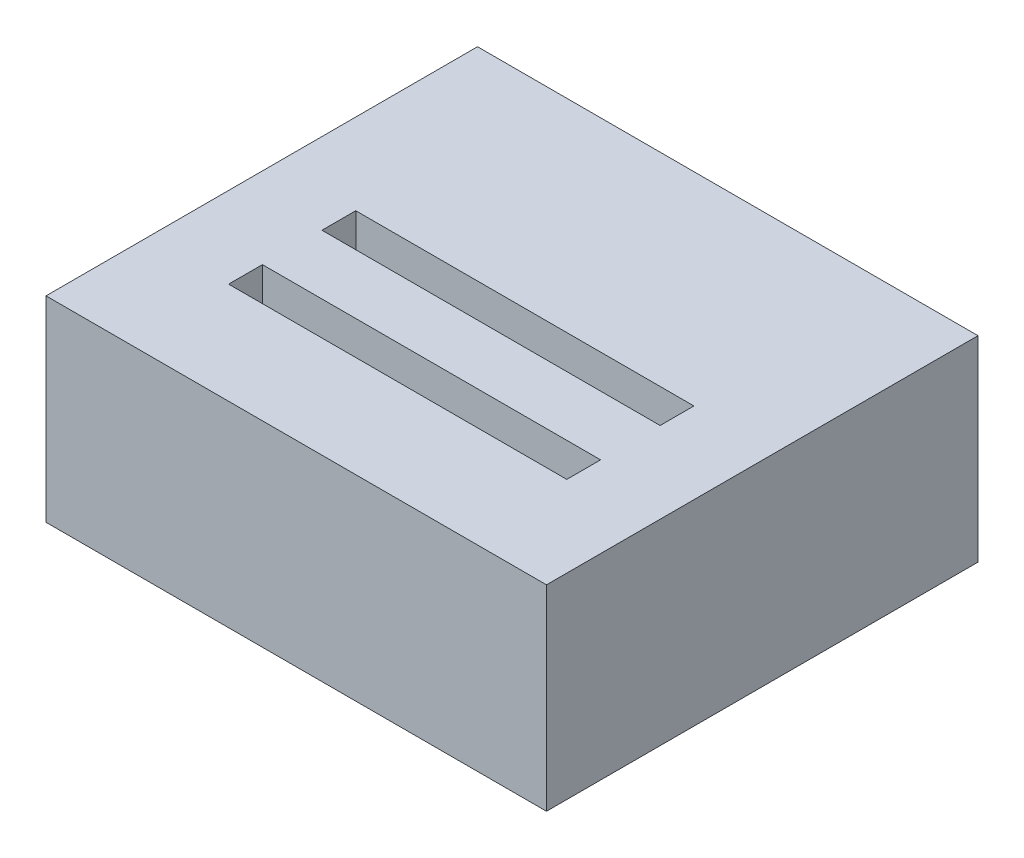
SolidWorks part; units mm, degrees
ref_plane "Front Plane" through (0, 0, 0) normal (0, 0, 1) x (1, 0, 0)
ref_plane "Top Plane" through (0, 0, 0) normal (0, 1, 0) x (1, 0, 0)
ref_plane "Right Plane" through (0, 0, 0) normal (1, 0, 0) x (0, 0, -1)
sketch "Sketch1" plane through (0, 0, 0) normal (0, 0, 1) x (1, 0, 0)
  line L1 (-4.318, 4.953) -> (14.478, 4.953)
  line L2 (-4.318, 4.953) -> (-4.318, -2.413)
  line L3 (-4.318, -2.413) -> (14.478, -2.413)
  line L4 (14.478, 4.953) -> (14.478, -2.413)
extrude "Boss-Extrude1" add sketch "Sketch1" along normal blind 7.62
sketch "Sketch2" plane through (0, 0, 0) normal (0, 0, -1) x (-1, 0, 0)
  circle A0 centre (0, 0) radius 0.508
  circle A1 centre (-2.54, 0) radius 0.508
  circle A2 centre (-5.08, 0) radius 0.508
  circle A3 centre (-7.62, 0) radius 0.508
  circle A4 centre (-10.16, 0) radius 0.508
  circle A12 centre (0, 2.54) radius 0.508
  circle A13 centre (-2.54, 2.54) radius 0.508
  circle A14 centre (-5.08, 2.54) radius 0.508
  circle A15 centre (-7.62, 2.54) radius 0.508
  circle A16 centre (-10.16, 2.54) radius 0.508
extrude "Cut-Extrude1" cut sketch "Sketch2" against normal up to surface (7.62 mm away)
sketch "Sketch3" plane through (0, 0, 7.62) normal (0, 0, 1) x (1, 0, 0)
  line L0 (-4.318, -2.413) -> (14.478, -2.413) construction
  line L1 (-4.318, 4.953) -> (-1.27, 4.953)
  line L2 (-4.318, 4.953) -> (-4.318, -2.413)
  line L3 (-4.318, -2.413) -> (-1.27, -2.413)
  line L4 (-1.27, 4.953) -> (-1.27, -2.413)
  line L6 (14.478, 4.953) -> (11.43, 4.953)
  line L7 (14.478, 4.953) -> (14.478, -2.413)
  line L8 (14.478, -2.413) -> (11.43, -2.413)
  line L9 (11.43, 4.953) -> (11.43, -2.413)
extrude "Boss-Extrude2" add sketch "Sketch3" along normal blind 1.27
sketch "Sketch4" plane through (0, 0, 8.89) normal (0, 0, 1) x (1, 0, 0)
  line L1 (-4.318, 4.953) -> (14.478, 4.953)
  line L2 (-4.318, 4.953) -> (-4.318, -2.413)
  line L3 (-4.318, -2.413) -> (14.478, -2.413)
  line L4 (14.478, 4.953) -> (14.478, -2.413)
extrude "Boss-Extrude3" add sketch "Sketch4" along normal blind 2.2352
sketch "Sketch5" plane through (0, 0, 11.1252) normal (0, 0, 1) x (1, 0, 0)
  line L0 (-4.318, -2.413) -> (14.478, -2.413) construction
  line L1 (-4.318, 4.953) -> (-1.27, 4.953)
  line L2 (-4.318, 4.953) -> (-4.318, -2.413)
  line L3 (-4.318, -2.413) -> (-1.27, -2.413)
  line L4 (-1.27, 4.953) -> (-1.27, -2.413)
  line L6 (14.478, 4.953) -> (11.43, 4.953)
  line L7 (14.478, 4.953) -> (14.478, -2.413)
  line L8 (14.478, -2.413) -> (11.43, -2.413)
  line L9 (11.43, 4.953) -> (11.43, -2.413)
extrude "Boss-Extrude4" add sketch "Sketch5" along normal blind 1.27
sketch "Sketch6" plane through (0, 0, 12.3952) normal (0, 0, 1) x (1, 0, 0)
  line L1 (-4.318, 4.953) -> (14.478, 4.953)
  line L2 (-4.318, 4.953) -> (-4.318, -2.413)
  line L3 (-4.318, -2.413) -> (14.478, -2.413)
  line L4 (14.478, 4.953) -> (14.478, -2.413)
extrude "Boss-Extrude5" add sketch "Sketch6" along normal blind 3.81
sketch "Sketch7" plane through (0, -2.413, 0) normal (0, -1, 0) x (1, 0, 0)
  line L1 (-4.318, 0) -> (14.478, 0) construction
  line L2 (2.667, 0) -> (7.493, 0)
  line L3 (2.667, 0) -> (2.667, 7.62)
  line L4 (2.667, 7.62) -> (7.493, 7.62)
  line L5 (7.493, 0) -> (7.493, 7.62)
  line L6 (-1.27, 7.62) -> (11.43, 7.62) construction
extrude "Boss-Extrude6" add sketch "Sketch7" along normal blind 0.635
